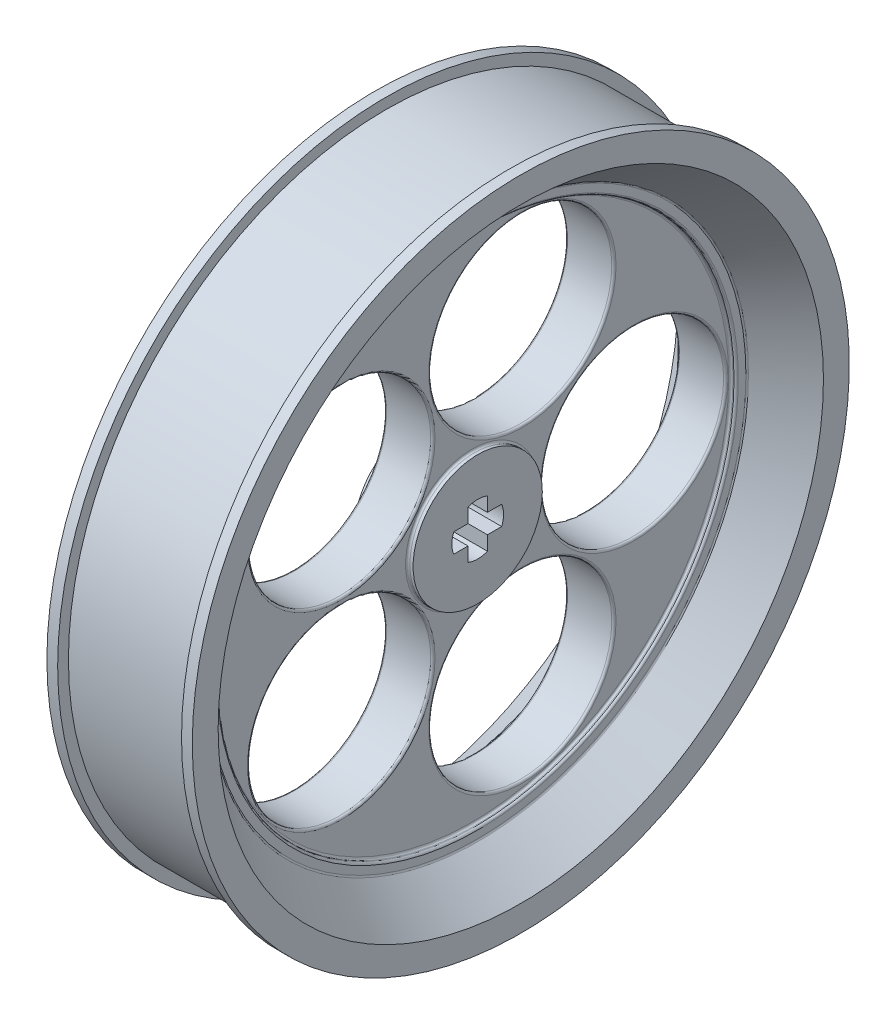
SolidWorks part; units mm, degrees
ref_plane "Front Plane" through (0, 0, 0) normal (0, 0, 1) x (1, 0, 0)
ref_plane "Top Plane" through (0, 0, 0) normal (0, 1, 0) x (1, 0, 0)
ref_plane "Right Plane" through (0, 0, 0) normal (1, 0, 0) x (0, 0, -1)
sketch "Sketch1" plane through (0, 0, 0) normal (0, 0, 1) x (1, 0, 0)
  line L0 (-106.3625, 0) -> (136.2052, 0) construction
  line L1 (-2.75, 0) -> (-2.75, 25)
  line L2 (-2.75, 25) -> (-6.75, 28.1)
  line L3 (-6.75, 28.1) -> (-6.75, 30.5)
  line L4 (-6.75, 30.5) -> (-5.75, 30.5)
  line L5 (6.75, 30.5) -> (6.75, 28.1)
  line L6 (6.75, 28.1) -> (2.75, 25)
  line L7 (2.75, 25) -> (2.75, 0)
  line L8 (-5.75, 30.5) -> (-5.75, 29.5)
  line L9 (-5.75, 29.5) -> (5.75, 29.5)
  line L10 (5.75, 29.5) -> (5.75, 30.5)
  line L11 (5.75, 30.5) -> (6.75, 30.5)
  line L12 (-2.75, 0) -> (2.75, 0)
  dimension "D1" = 5.5
  dimension "D2" = 2.75
  dimension "D3" = 61
  dimension "D4" = 2.4
  dimension "D5" = 2.4
  dimension "D6" = 25
  dimension "D7" = 25
  dimension "D8" = 1
  dimension "D9" = 13.5
  dimension "D10" = 6.75
  dimension "D11" = 1
  dimension "D12" = 1
revolve "Revolve1" add sketch "Sketch1" angle 360 about L0
sketch "Sketch2" plane through (2.75, 0, 0) normal (1, 0, 0) x (0, 0, -1)
  line L0 (-4.6239, 0) -> (8.3093, 0) construction
  line L1 (0, 3.7883) -> (0, -3.795) construction
  line L2 (-2.2249, 0.9) -> (-0.9, 0.9)
  line L3 (-2.2249, -0.9) -> (-0.9, -0.9)
  line L4 (-0.9, 2.2249) -> (-0.9, 0.9)
  line L5 (0.9, 2.2249) -> (0.9, 0.9)
  line L6 (-0.9, -0.9) -> (-0.9, -2.2249)
  line L7 (0.9, -0.9) -> (2.2249, -0.9)
  line L8 (0.9, 0.9) -> (2.2249, 0.9)
  line L9 (0.9, -0.9) -> (0.9, -2.2249)
  arc A0 (-2.2249, 0.9) -> (-2.2249, -0.9) centre (0, 0) ccw
  arc A1 (0.9, 2.2249) -> (-0.9, 2.2249) centre (0, 0) ccw
  arc A2 (2.2249, -0.9) -> (2.2249, 0.9) centre (0, 0) ccw
  arc A3 (-0.9, -2.2249) -> (0.9, -2.2249) centre (0, 0) ccw
  dimension "D1" = 4.8
  dimension "D2" = 0.9
  dimension "D3" = 0.9
  dimension "D4" = 1.8
  dimension "D5" = 1.8
extrude "Cut-Extrude1" cut sketch "Sketch2" against normal through all
sketch "Sketch3" plane through (-2.75, 0, 0) normal (-1, 0, 0) x (0, 0, 1)
  circle A0 centre (0, 0) radius 6
  circle A2 centre (0, 0) radius 24
  dimension "D1" = 12
  dimension "D2" = 48
extrude "Cut-Extrude2" cut sketch "Sketch3" against normal blind 0.5
sketch "Sketch4" plane through (2.75, 0, 0) normal (1, 0, 0) x (0, 0, -1)
  circle A0 centre (0, 0) radius 6
  circle A2 centre (0, 0) radius 24
  dimension "D1" = 12
  dimension "D2" = 48
extrude "Cut-Extrude3" cut sketch "Sketch4" against normal blind 0.5
sketch "Sketch5" plane through (2.25, 0, 0) normal (1, 0, 0) x (0, 0, -1)
  circle A0 centre (15.0339, 0) radius 8.5
  dimension "D1" = 17
extrude "Cut-Extrude5" cut sketch "Sketch5" against normal through all
pattern_circular "CirPattern7" count 5 over 360 about axis through (0, 0, 0) along (1, 0, 0) of "Cut-Extrude5"
fillet "Fillet1" radius 0.2 3 edges at (2.75, 0, -24) (2.25, 0, -24) (2.75, 0, 25)
fillet "Fillet2" radius 0.2 14 edges at (-2.25, -6.2141, -2.0191) (-2.25, -3.8405, 5.286) (-2.25, 3.8405, 5.286) (-2.25, 0, -6.5339) (-2.25, 6.2141, -2.0191) (-2.25, 0, 24) (-2.75, 0, 24) (-2.75, 0, 25) (2.25, -22.382, -7.2724) (2.25, -13.8329, 19.0393) (2.25, 0, -6) (2.25, 0, -23.5339) (2.25, 13.8329, 19.0393) (2.25, 22.382, -7.2724)
